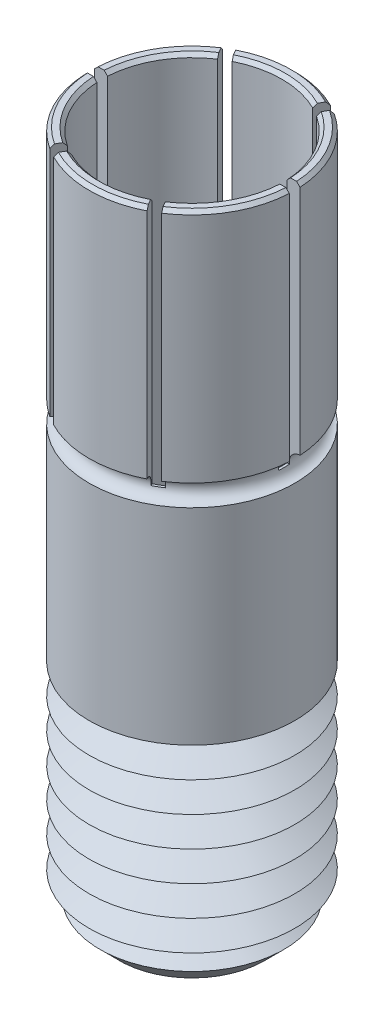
SolidWorks part; units mm, degrees
ref_plane "Front Plane" through (0, 0, 0) normal (0, 0, 1) x (1, 0, 0)
ref_plane "Top Plane" through (0, 0, 0) normal (0, 1, 0) x (1, 0, 0)
ref_plane "Right Plane" through (0, 0, 0) normal (1, 0, 0) x (0, 0, -1)
sketch "Sketch1" plane through (0, 0, 0) normal (1, 0, 0) x (0, 0, -1)
  line L0 (0, 63.0319) -> (0, -63.6896) construction
sketch "Sketch2" plane through (0, 0, 0) normal (1, 0, 0) x (0, 0, -1)
  line L0 (-5.25, 1.8253) -> (-5.25, -25.1747)
  line L1 (-5.25, -25.1747) -> (-6, -25.1747)
  line L2 (-6, -25.1747) -> (-6, -13.1747)
  line L3 (-6, 1.8253) -> (-5.25, 1.8253)
  line L4 (0, 63.0319) -> (0, -63.6896) construction
  line L6 (-6, -11.9247) -> (-6, 1.8253)
  arc A0 (-6, -13.1747) -> (-6, -11.9247) centre (-6, -12.5497) ccw
  point P10 (-6, -13.1747)
  point P11 (-6, -11.9247)
  point P12 (-6, -13.1747)
  point P13 (-6, -11.9247)
  dimension "D3" = 1.25
  dimension "D1" = 5.25
  dimension "D2" = 6
  dimension "D4" = 15
  dimension "D5" = 27
revolve "Revolve1" add sketch "Sketch2" angle 360 about L0
chamfer "Chamfer1" distance 0.2 angle 45 2 edges at (0, 1.8253, 6) (0, 1.8253, 5.25)
sketch "Sketch5" plane through (0, 1.8253, 0) normal (0, 1, 0) x (1, 0, 0)
  line L2 (-2.9837, -0.3125) -> (-5.9919, -0.3125)
  line L4 (-2.9837, 0.3125) -> (-5.9919, 0.3125)
  line L6 (-2.9932, -0.2013) -> (-5.9996, 0.0734) construction
  line L7 (-2.9932, 0.2013) -> (-5.9995, 0.0806) construction
  arc A0 (-2.9837, 0.3125) -> (-2.9837, -0.3125) centre (0, 0) ccw
  arc A1 (-5.9919, 0.3125) -> (-5.9919, -0.3125) centre (0, 0) ccw
  circle A2 centre (0, 0) radius 6 construction
  point P3 (-6.0538, 0.0784)
  dimension "D1" = 3
extrude "Cut-Extrude1" cut sketch "Sketch5" against normal blind 14.5
pattern_circular "CirPattern1" count 6 over 360 about axis through (0, 0, 0) along (0, 1, 0) of "Cut-Extrude1"
sketch "Sketch8" plane through (0, -25.1747, 0) normal (0, -1, 0) x (1, 0, 0)
  circle A0 centre (0, 0) radius 6
  dimension "D1" = 12
extrude "Boss-Extrude1" add sketch "Sketch8" along normal blind 13
chamfer "Chamfer2" distance 1.75 angle 45 1 edges at (0, -38.1747, -6)
sketch "Sketch10" plane through (0, 0, 0) normal (1, 0, 0) x (0, 0, -1)
  line L0 (6, -25.1747) -> (4.4845, -26.0497)
  line L1 (6, -36.4247) -> (6, -13.1747) construction
  line L2 (4.4845, -26.0497) -> (6, -26.9247)
  line L3 (6, -36.4247) -> (6, -13.1747) construction
  line L4 (6, -26.9247) -> (6, -25.1747)
  line L5 (-4.25, -38.1747) -> (4.25, -38.1747) construction
  point P8 (6, -25.1747)
  point P9 (6, -25.1747)
  dimension "D1" = 1.75
  dimension "D2" = 13
revolve "Cut-Revolve1" cut sketch "Sketch10" angle 360 about L0
pattern_linear "LPattern1" count 7 spacing 1.75 along (0, -1, 0) of "Cut-Revolve1"
